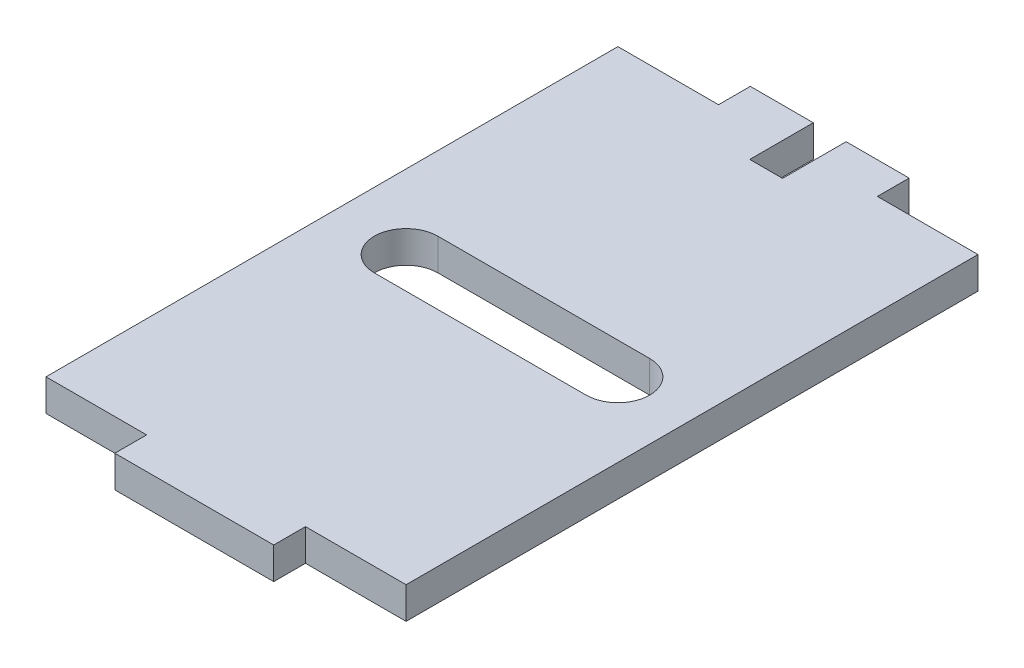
SolidWorks part; units mm, degrees
ref_plane "Front Plane" through (0, 0, 0) normal (0, 0, 1) x (1, 0, 0)
ref_plane "Top Plane" through (0, 0, 0) normal (0, 1, 0) x (1, 0, 0)
ref_plane "Right Plane" through (0, 0, 0) normal (1, 0, 0) x (0, 0, -1)
sketch "Sketch1" plane through (0, 0, 0) normal (0, 1, 0) x (1, 0, 0)
  line L1 (-17, 27) -> (17, 27)
  line L2 (-17, 27) -> (-17, -27)
  line L3 (-17, -27) -> (17, -27)
  line L4 (17, 27) -> (17, -27)
  line L5 (-17, 27) -> (17, -27) construction
  line L6 (-17, -27) -> (17, 27) construction
  point P0 (0, 0)
  dimension "D1" = 34
  dimension "D2" = 54
extrude "Boss-Extrude1" add sketch "Sketch1" along normal blind 3
sketch "Sketch2" plane through (0, 0, 0) normal (0, 1, 0) x (1, 0, 0)
  line L0 (0, 0) -> (5.3166, 0) construction
  line L1 (0, 27) -> (0, 28.5) construction
  line L2 (17, 27) -> (-17, 27) construction
  line L3 (-7.5, -27) -> (7.5, -30) construction
  line L4 (-7.5, 30) -> (7.5, 30)
  line L5 (-7.5, 30) -> (-7.5, 27)
  line L6 (-7.5, 27) -> (7.5, 27)
  line L7 (7.5, 30) -> (7.5, 27)
  line L8 (-7.5, 30) -> (7.5, 27) construction
  line L9 (-7.5, 27) -> (7.5, 30) construction
  line L10 (-7.5, -30) -> (7.5, -27) construction
  line L11 (0, -27) -> (0, -28.5) construction
  line L12 (7.5, -30) -> (7.5, -27)
  line L13 (-7.5, -27) -> (7.5, -27)
  line L14 (-7.5, -30) -> (-7.5, -27)
  line L15 (-7.5, -30) -> (7.5, -30)
  dimension "D1" = 3
  dimension "D2" = 15
extrude "Boss-Extrude2" add sketch "Sketch2" along normal blind 3
sketch "Sketch3" plane through (0, 0, 0) normal (0, 1, 0) x (1, 0, 0)
  line L0 (-10, 0) -> (10, 0) construction
  line L1 (-10, 3) -> (10, 3)
  line L2 (-10, -3) -> (10, -3)
  circle A0 centre (0, 0) radius 2.375 construction
  arc A1 (-10, 3) -> (-10, -3) centre (-10, 0) ccw
  arc A2 (10, -3) -> (10, 3) centre (10, 0) ccw
  point P5 (0, 0)
  dimension "D1" = 4.75
  dimension "D2" = 6
  dimension "D3" = 20
extrude "Cut-Extrude1" cut sketch "Sketch3" along normal blind 3
sketch "Sketch4" plane through (0, 0, 0) normal (0, 1, 0) x (1, 0, 0)
  line L0 (0, 30) -> (0, 27) construction
  line L2 (7.5, 30) -> (-7.5, 30) construction
  line L3 (7.5, 30) -> (-7.5, 30) construction
  line L4 (-1.55, 24) -> (1.55, 24)
  line L5 (-1.55, 24) -> (-1.55, 30)
  line L6 (-1.55, 30) -> (1.55, 30)
  line L7 (1.55, 24) -> (1.55, 30)
  line L8 (-1.55, 24) -> (1.55, 30) construction
  line L9 (-1.55, 30) -> (1.55, 24) construction
  dimension "D1" = 3.1
  dimension "D2" = 6
extrude "Cut-Extrude2" cut sketch "Sketch4" along normal blind 10
